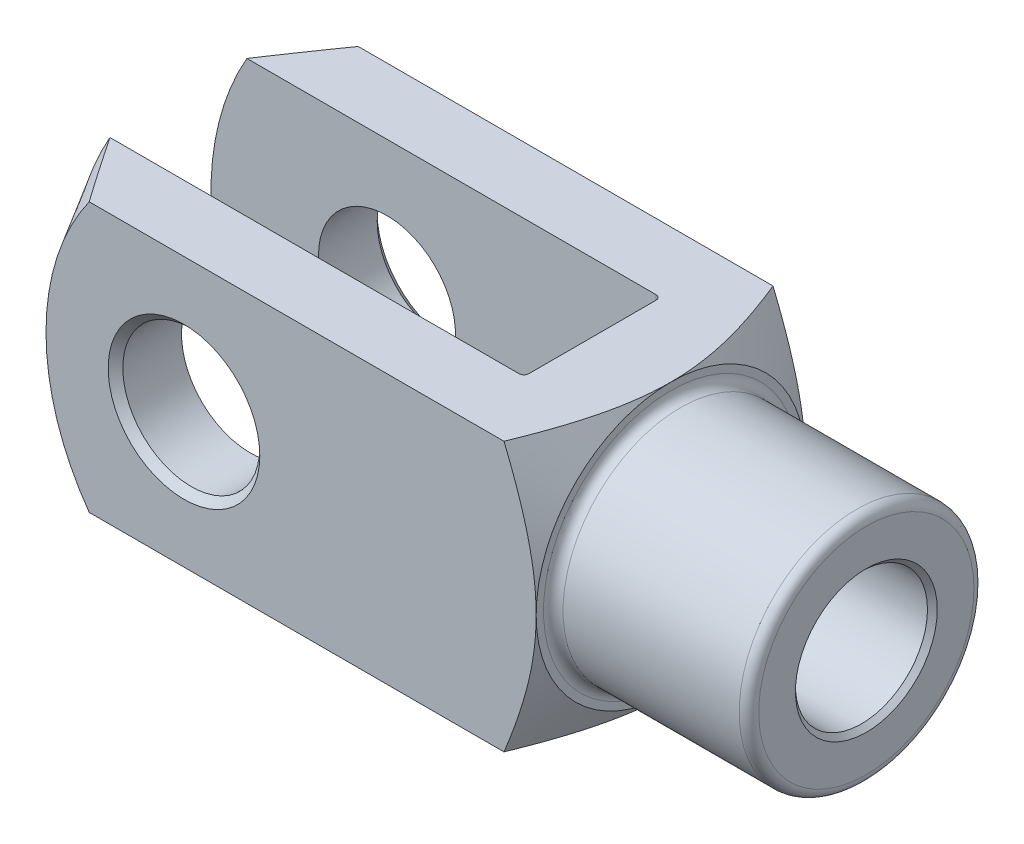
SolidWorks part; units mm, degrees
ref_plane "Front Plane" through (0, 0, 0) normal (0, 0, 1) x (1, 0, 0)
ref_plane "Top Plane" through (0, 0, 0) normal (0, 1, 0) x (1, 0, 0)
ref_plane "Right Plane" through (0, 0, 0) normal (1, 0, 0) x (0, 0, -1)
sketch "Sketch1" plane through (0, 0, 0) normal (1, 0, 0) x (0, 0, -1)
  line L0 (0, 0) -> (0, 50000) construction
  line L1 (0, 0) -> (50000, 0) construction
  line L2 (-27.5, -27.5) -> (-27.5, 27.5)
  line L3 (-27.5, 27.5) -> (27.5, 27.5)
  line L4 (27.5, -27.5) -> (27.5, 27.5)
  line L5 (-27.5, -27.5) -> (27.5, -27.5)
  point P9 (0, 27.5)
  point P11 (27.5, 0)
  point P12 (-27.5, 0)
  dimension "D1" = 55
  dimension "D2" = 55
extrude "Extrude1" add sketch "Sketch1" against normal blind 148
sketch "Sketch2" plane through (0, 0, 0) normal (1, 0, 0) x (0, 0, -1)
  circle A0 centre (0, 0) radius 24
  circle A1 centre (0, 0) radius 48
  dimension "D1" = 48
  dimension "D2" = 96
extrude "Extrude2" cut sketch "Sketch2" against normal blind 40
sketch "Sketch3" plane through (0, 0, 27.5) normal (0, 0, 1) x (1, 0, 0)
  circle A0 centre (-112, 0) radius 14
  dimension "D1" = 28
  dimension "D2" = 112
extrude "Extrude3" cut sketch "Sketch3" against normal through all
sketch "Sketch4" plane through (0, 27.5, 0) normal (0, 1, 0) x (1, 0, 0)
  line L0 (0, 0) -> (-50000, 0) construction
  line L1 (-148, -14) -> (-148, 14)
  line L2 (-148, 27.5) -> (-148, -27.5) construction
  line L3 (-148, 14) -> (-56, 14)
  line L4 (-56, 14) -> (-56, -14)
  line L5 (-112, 27.5) -> (-112, -27.5) construction
  line L6 (-148, -14) -> (-56, -14)
  point P7 (-112, 0)
  point P13 (-56, 0)
  point P14 (-148, 0)
  dimension "D1" = 56
  dimension "D2" = 28
extrude "Extrude4" cut sketch "Sketch4" against normal through all
fillet "Fillet1" radius 1 2 edges at (-56, 0, 14) (-56, 0, -14)
fillet "Fillet2" radius 2 2 edges at (0, 0, -24) (-40, 0, -24)
chamfer "Chamfer2" distance 1.5 angle 45 2 edges at (-98, 0, -27.5) (-98, 0, 27.5)
sketch "Sketch6" plane through (0, 0, 0) normal (0, 0, 1) x (1, 0, 0)
  line L0 (-40, -27.5) -> (-40, -55)
  line L1 (-40, -55) -> (-55.8771, -55)
  line L2 (-55.8771, -55) -> (-40, -27.5)
  dimension "D1" = 30
  dimension "D2" = 55
revolve "Cut-Revolve1" cut sketch "Sketch6" angle 360 about axis through (-40, 0, 0) along (1, 0, 0)
sketch "Sketch7" plane through (0, 0, 0) normal (0, 1, 0) x (1, 0, 0)
  line L0 (-140.2058, -27.5) -> (-148, -14)
  line L1 (-148, 14) -> (-140.2058, 27.5)
  line L2 (-140.2058, 27.5) -> (-203, 27.5)
  line L3 (-148, 14) -> (-148, -14)
  line L4 (-203, 27.5) -> (-203, -27.5)
  line L5 (-203, -27.5) -> (-140.2058, -27.5)
  line L6 (-148, 27.5) -> (-46.5765, 27.5) construction
  line L7 (-148, -27.5) -> (-46.5765, -27.5) construction
  line L8 (-93, 0.6162) -> (-93, 50000.6162) construction
  dimension "D1" = 120
  dimension "D2" = 55
  dimension "D3" = 55
revolve "Cut-Revolve2" cut sketch "Sketch7" angle 180 about L8
sketch "Sketch8" plane through (0, 0, 0) normal (1, 0, 0) x (0, 0, -1)
  circle A0 centre (0, 0) radius 13.5
  dimension "D1" = 27
extrude "Extrude5" cut sketch "Sketch8" against normal through all
chamfer "Chamfer3" distance 1 angle 45 1 edges at (0, 0, -13.5)
equation "\"D2@Sketch1\" = \"D1@Sketch1\""
equation "\"D2@Sketch2\" = \"D1@Sketch2\"*2"
equation "\"D2@Sketch6\" = \"D1@Sketch1\""
equation "\"D2@Sketch7\" = \"D1@Sketch1\""
equation "\"D3@Sketch7\" = \"D1@Sketch1\""
